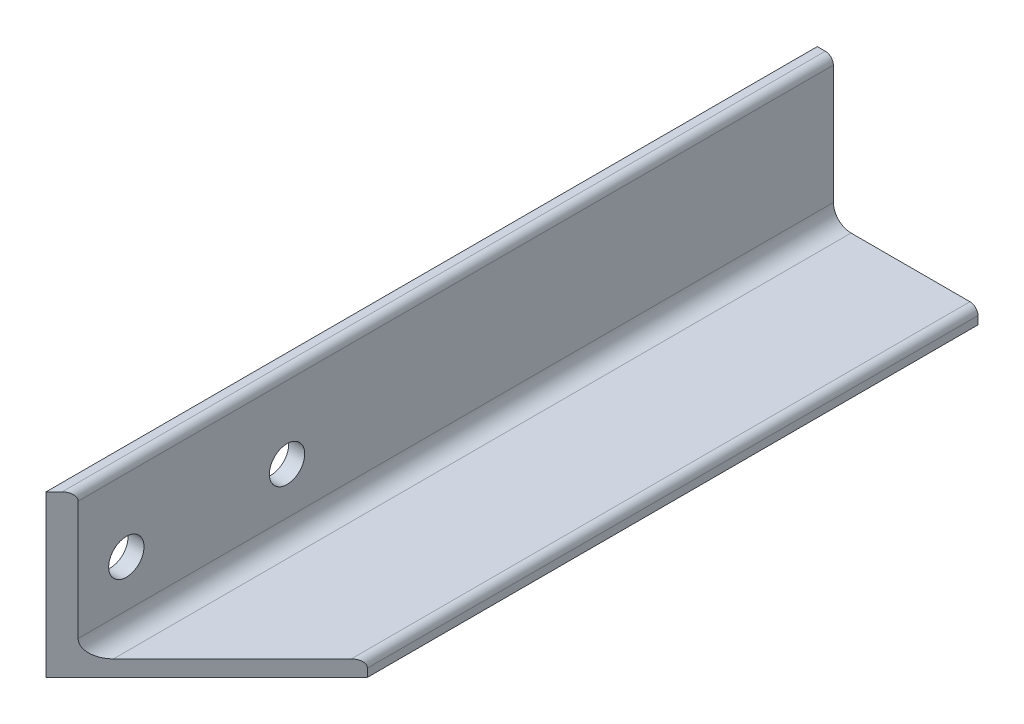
SolidWorks part; units mm, degrees
ref_plane "前视基准面" through (0, 0, 0) normal (0, 0, 1) x (1, 0, 0)
ref_plane "上视基准面" through (0, 0, 0) normal (0, 1, 0) x (1, 0, 0)
ref_plane "右视基准面" through (0, 0, 0) normal (1, 0, 0) x (0, 0, -1)
sketch "草图1" plane through (0, 0, 0) normal (0, 0, 1) x (1, 0, 0)
  line L0 (0, 50) -> (0, 0)
  line L1 (0, 0) -> (50, 0)
  line L2 (50, 0) -> (50, 2.5)
  line L3 (47.5, 5) -> (10.5, 5)
  line L4 (5, 10.5) -> (5, 47.5)
  line L5 (2.5, 50) -> (0, 50)
  arc A0 (10.5, 5) -> (5, 10.5) centre (10.5, 10.5) cw
  arc A1 (50, 2.5) -> (47.5, 5) centre (47.5, 2.5) ccw
  arc A2 (5, 47.5) -> (2.5, 50) centre (2.5, 47.5) ccw
  point P13 (5, 50)
  dimension "D5" = 5.5
  dimension "D6" = 2.5
  dimension "D1" = 50
  dimension "D2" = 50
  dimension "D3" = 5
  dimension "D4" = 5
extrude "拉伸1" add sketch "草图1" along normal blind 240
sketch "草图2" plane through (0, 0, 0) normal (0, -1, 0) x (1, 0, 0)
  line L0 (50, 240) -> (50, 190)
  line L1 (50, 240) -> (50, 0) construction
  line L2 (50, 190) -> (0, 240)
  line L3 (0, 240) -> (50, 240)
  dimension "D1" = 50
extrude "切除-拉伸1" cut sketch "草图2" against normal blind 240
sketch "草图3" plane through (0, 0, 0) normal (-1, 0, 0) x (0, 0, 1)
  line L0 (123.9419, 25) -> (268.9081, 25) construction
  line L1 (240, 50) -> (240, 0) construction
  line L2 (240, 50) -> (0, 50) construction
  circle A0 centre (220, 25) radius 5.5
  circle A1 centre (170, 25) radius 5.5
  dimension "D1" = 20
  dimension "D2" = 50
  dimension "D4" = 11
  dimension "D5" = 11
  dimension "D3" = 25
extrude "切除-拉伸2" cut sketch "草图3" against normal blind 240
